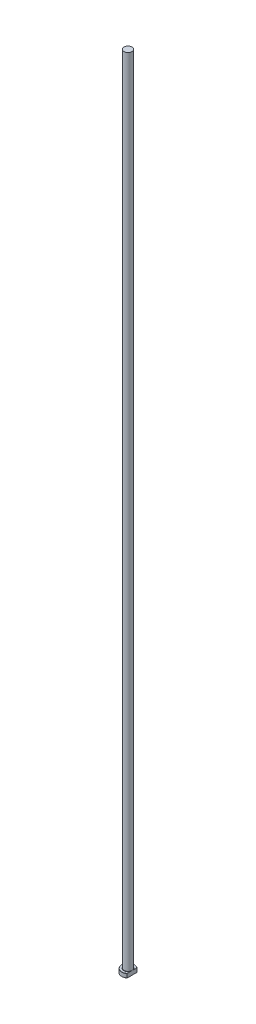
SolidWorks part; units mm, degrees
ref_plane "Front Plane" through (0, 0, 0) normal (0, 0, 1) x (1, 0, 0)
ref_plane "Top Plane" through (0, 0, 0) normal (0, 1, 0) x (1, 0, 0)
ref_plane "Right Plane" through (0, 0, 0) normal (1, 0, 0) x (0, 0, -1)
sketch "Sketch1" plane through (0, 0, 0) normal (0, 0, 1) x (1, 0, 0)
  line L0 (0, 259.9588) -> (0, -15.1925) construction
  line L1 (0, 0) -> (-8, 0)
  line L2 (-8, 0) -> (-8, 5)
  line L3 (-8, 5) -> (-5, 5)
  line L4 (-5, 5) -> (-5, 1000)
  line L5 (-5, 1000) -> (0, 1000)
  line L6 (0, 1000) -> (0, 0)
  dimension "L" = 1000
  dimension "H" = 16
  dimension "T" = 5
  dimension "D" = 10
revolve "Revolve1" add sketch "Sketch1" angle 360 about L0
chamfer "Chamfer1" distance 0.2 angle 45 2 edges at (0, 5, 8) (0, 0, 8)
fillet "Fillet1" radius 0.3 1 edges at (0, 5, 5)
sketch "Sketch2" plane through (0, 0, 0) normal (0, 1, 0) x (1, 0, 0)
  line L0 (5, 6.245) -> (5, -6.245)
  circle A0 centre (0, 0) radius 8 construction
  arc A1 (5, -6.245) -> (5, 6.245) centre (0, 0) ccw
  circle A2 centre (0, 0) radius 5 construction
extrude "KEY" cut sketch "Sketch2" along normal through all
